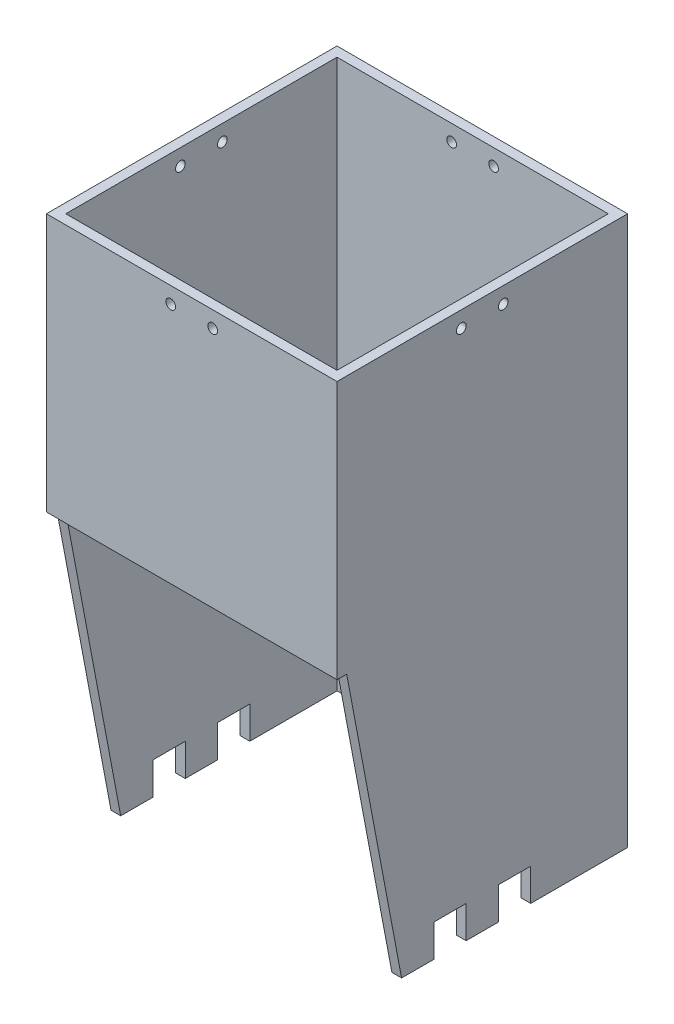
SolidWorks part; units mm, degrees
ref_plane "Front" through (0, 0, 0) normal (0, 0, 1) x (1, 0, 0)
ref_plane "Top" through (0, 0, 0) normal (0, 1, 0) x (1, 0, 0)
ref_plane "Right" through (0, 0, 0) normal (1, 0, 0) x (0, 0, -1)
sketch "草图1" plane through (0, 0, 0) normal (0, 1, 0) x (1, 0, 0)
  line L0 (-42, 42) -> (-42, -42)
  line L1 (-45, -45) -> (45, -45)
  line L2 (-45, -45) -> (-45, 45)
  line L3 (-45, 45) -> (45, 45)
  line L4 (45, -45) -> (45, 45)
  line L5 (-45, -45) -> (45, 45) construction
  line L6 (-45, 45) -> (45, -45) construction
  line L7 (-42, -42) -> (42, -42)
  line L8 (42, -42) -> (42, 42)
  line L9 (42, 42) -> (-42, 42)
  point P0 (0, 0)
  dimension "D1" = 90
  dimension "D2" = 90
  dimension "D3" = 3
extrude "凸台-拉伸1" add sketch "草图1" along normal blind 170
sketch "草图2" plane through (0, 0, 45) normal (0, 0, 1) x (1, 0, 0)
  line L0 (45, 170) -> (45, 0) construction
  line L1 (-45, 170) -> (45, 170) construction
  circle A0 centre (6.5, 165) radius 1.5
  circle A1 centre (-6.5, 165) radius 1.5
  dimension "D3" = 3
  dimension "D4" = 3
  dimension "D1" = 13
  dimension "D2" = 38.5
  dimension "D5" = 5
  dimension "D6" = 5
extrude "切除-拉伸1" cut sketch "草图2" against normal up to surface (90 mm away)
sketch "草图3" plane through (45, 0, 0) normal (1, 0, 0) x (0, 0, -1)
  line L0 (45, 170) -> (45, 0) construction
  line L1 (-45, 170) -> (45, 170) construction
  circle A0 centre (6.5, 165) radius 1.5
  circle A1 centre (-6.5, 165) radius 1.5
  dimension "D2" = 38.5
  dimension "D3" = 5
  dimension "D5" = 3
  dimension "D6" = 3
  dimension "D1" = 13
  dimension "D4" = 5
extrude "切除-拉伸2" cut sketch "草图3" against normal up to surface (90 mm away)
sketch "草图4" plane through (45, 0, 0) normal (1, 0, 0) x (0, 0, -1)
  line L1 (5, 0) -> (15, 0)
  line L2 (5, 0) -> (5, 10)
  line L3 (5, 10) -> (15, 10)
  line L4 (15, 0) -> (15, 10)
  line L5 (-5, 0) -> (-15, 0)
  line L6 (-5, 0) -> (-5, 10)
  line L7 (-5, 10) -> (-15, 10)
  line L8 (-15, 0) -> (-15, 10)
extrude "切除-拉伸3" cut sketch "草图4" against normal up to surface (90 mm away)
sketch "草图5" plane through (45, 0, 0) normal (1, 0, 0) x (0, 0, -1)
  line L1 (-45, 170) -> (-45, 0) construction
  line L2 (-45, 0) -> (-15, 0) construction
  line L3 (-25, 0) -> (-45, 0)
  line L4 (-45, 0) -> (-45, 90)
  line L6 (-45, 90) -> (-42, 90)
  line L7 (-42, 90) -> (-25, 0)
  dimension "D1" = 20
  dimension "D2" = 90
  dimension "D3" = 3
extrude "切除-拉伸4" cut sketch "草图5" against normal up to surface (90 mm away)
